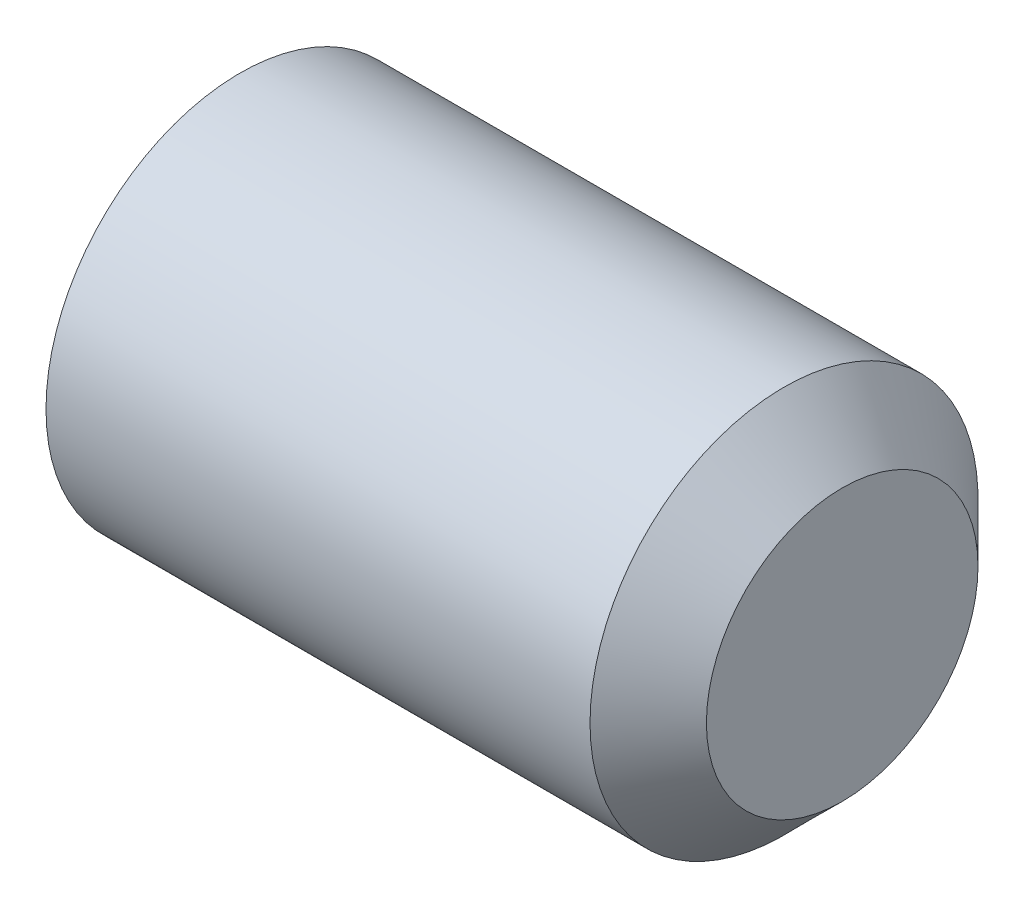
SolidWorks part; units mm, degrees
ref_plane "Plane1" through (0, 0, 0) normal (0, 0, 1) x (1, 0, 0)
ref_plane "Plane2" through (0, 0, 0) normal (0, 1, 0) x (1, 0, 0)
ref_plane "Plane3" through (0, 0, 0) normal (1, 0, 0) x (0, 0, -1)
sketch "BodySke" plane through (0, 0, 0) normal (0, 0, 1) x (1, 0, 0)
  line L0 (0, 0) -> (0, 4.172)
  line L1 (0, 4.172) -> (0.478, 5)
  line L2 (0.478, 5) -> (14.5, 5)
  line L3 (14.5, 5) -> (16, 3.5)
  line L4 (16, 0) -> (0, 0)
  line L5 (-12.7, 0) -> (88.9, 0) construction
  line L6 (16, 3.5) -> (16, 0)
  line L7 (16, 3.5) -> (16, 13.025) construction
  line L8 (0, -4.172) -> (0.478, -5) construction
  line L9 (1.5, 15.875) -> (1.5, -3.175) construction
  line L10 (14.5, -5) -> (16, -3.5) construction
  dimension "Length" = 16
  dimension "Diameter" = 10
  dimension "Drive_ch_ang" = 60
  dimension "Minor_dia" = 8.344
  dimension "Cup_nose_ang" = 45
  dimension "Cup_dia" = 7
  dimension "Advance" = 1.5
revolve "BaseBody" add sketch "BodySke" angle 360 about L5
sketch "Sketch2" plane through (0, 0, 0) normal (-1, 0, 0) x (0, 0, 1)
  line L0 (1.4434, 2.5) -> (-1.4434, 2.5)
  line L1 (-1.4434, 2.5) -> (-2.8868, 0)
  line L2 (1.4434, 2.5) -> (2.8868, 0)
  line L3 (1.4434, -2.5) -> (2.8868, 0)
  line L4 (1.4434, -2.5) -> (-1.4434, -2.5)
  line L5 (-1.4434, -2.5) -> (-2.8868, 0)
  dimension "Hex_size" = 5
  dimension "D2" = 2.5
  dimension "D3" = 2.5
extrude "Hex" cut sketch "Sketch2" against normal blind 6
sketch "ThdSchSke" plane through (0, 0, 0) normal (0, 0, 1) x (1, 0, 0)
  line L0 (0.478, -4.172) -> (-0.1017, -5)
  line L1 (0.478, -4.172) -> (1.0578, -5)
  line L2 (1.0578, -5) -> (1.0578, -6.25)
  line L3 (-3.175, 0) -> (5.1513, 0) construction
  line L5 (1.0578, -6.25) -> (-0.1017, -6.25)
  line L6 (-0.1017, -6.25) -> (-0.1017, -5)
  line L8 (0.478, 5) -> (0.478, -5) construction
  dimension "Thread_minor" = 8.344
  dimension "Diameter" = 10
  dimension "SideAngle" = 55
  dimension "VeeAngle" = 70
  dimension "Overcut" = 12.5
revolve "ThreadSchematic" [suppressed] cut sketch "ThdSchSke" angle 360 about L3
pattern_linear "ThdSchPat" [suppressed]
equation "\"D2@Sketch2\" = \"Hex_size@Sketch2\" / 2"
equation "\"D3@Sketch2\" = \"Hex_size@Sketch2\" / 2"
equation "\"Thread_minor@ThreadCosmetic\" = \"Minor_dia@BodySke\""
equation "\"Thread_minor@ThdSchSke\" = \"Thread_minor@ThreadCosmetic\""
equation "\"Diameter@ThdSchSke\" = \"Diameter@BodySke\""
equation "\"Overcut@ThdSchSke\" = \"Diameter@BodySke\" * 1.25"
equation "\"Num_threads@ThdSchPat\" = int( (\"Length@BodySke\" - ( ( ( \"Diameter@BodySke\" - \"Minor_dia@BodySke\" ) * 0.5 ) / tan( \"Drive_ch_ang@BodySke\" * 0.017453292 ) ) - ( ( ( \"Diameter@BodySke\" - \"Cup_dia@BodySk"
equation "\"Advance@ThdSchPat\" = (\"Length@BodySke\" - ( ( ( \"Diameter@BodySke\" - \"Minor_dia@BodySke\" ) * 0.5 ) / tan( \"Drive_ch_ang@BodySke\" * 0.017453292 ) ) - ( ( ( \"Diameter@BodySke\" - \"Cup_dia@BodySke\" ) * 0."
equation "' \"Num_threads@ThdSchPat\" = \"Num_threads@ThdSchPat\" - sgn( \"Num_threads@ThdSchPat\" - 1) '---chamfered tips only---"
